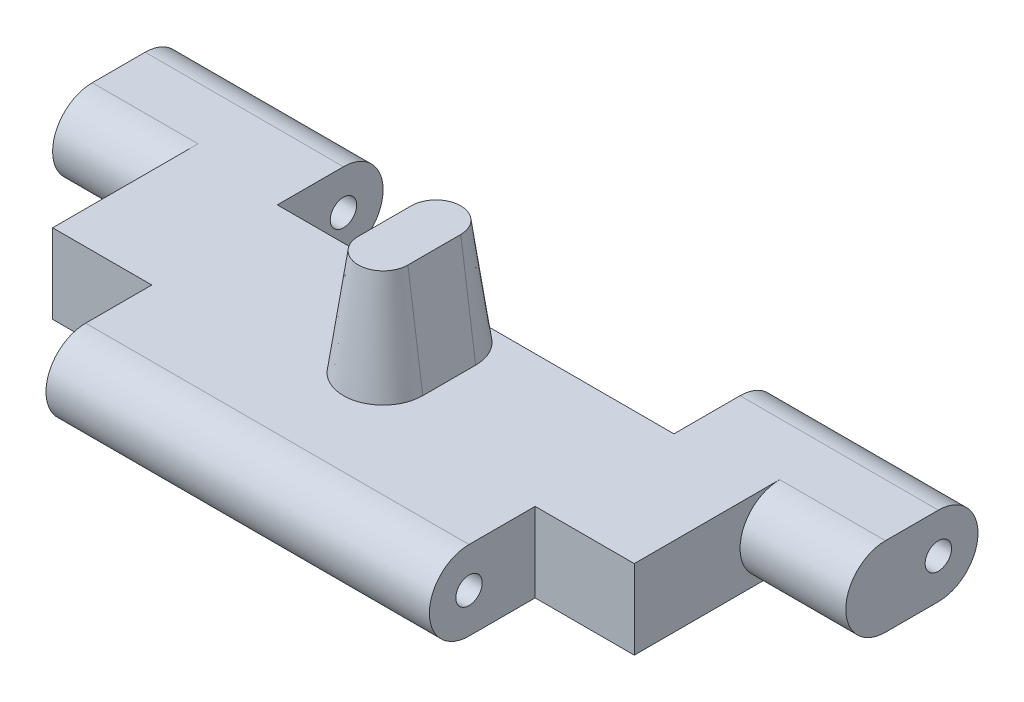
SolidWorks part; units mm, degrees
ref_plane "Plan de face" through (0, 0, 0) normal (0, 0, 1) x (1, 0, 0)
ref_plane "Plan de dessus" through (0, 0, 0) normal (0, 1, 0) x (1, 0, 0)
ref_plane "Plan de droite" through (0, 0, 0) normal (1, 0, 0) x (0, 0, -1)
sketch "Esquisse1" plane through (0, 0, 0) normal (1, 0, 0) x (0, 0, -1)
  line L0 (-5, 0) -> (5, 0) construction
  line L1 (-5, 1.5) -> (5, 1.5)
  line L2 (-5, -1.5) -> (5, -1.5)
  arc A0 (-5, 1.5) -> (-5, -1.5) centre (-5, 0) ccw
  arc A1 (5, -1.5) -> (5, 1.5) centre (5, 0) ccw
  circle A2 centre (-5, 0) radius 0.5
  circle A3 centre (5, 0) radius 0.5
  point P3 (0, 0)
  dimension "D3" = 1
  dimension "D1" = 3
  dimension "D2" = 10
extrude "Boss.-Extru.1" add sketch "Esquisse1" along normal mid plane 30
sketch "Esquisse2" plane through (0, 0, 0) normal (0, 1, 0) x (1, 0, 0)
  line L0 (15, 6.5) -> (-15, 6.5) construction
  line L1 (-7.5, 2.5) -> (7.5, 2.5)
  line L2 (-7.5, 2.5) -> (-7.5, 6.5)
  line L3 (-7.5, 6.5) -> (7.5, 6.5)
  line L4 (7.5, 2.5) -> (7.5, 6.5)
  line L5 (-15, -6.5) -> (-7.25, -6.5)
  line L6 (-15, -6.5) -> (-15, -2.5)
  line L7 (-15, -2.5) -> (-7.25, -2.5)
  line L8 (-7.25, -6.5) -> (-7.25, -2.5)
  line L9 (15, -6.5) -> (7.25, -6.5)
  line L10 (15, -6.5) -> (15, -2.5)
  line L11 (15, -2.5) -> (7.25, -2.5)
  line L12 (7.25, -6.5) -> (7.25, -2.5)
  line L13 (0, -10.0902) -> (0, 2.5) construction
  dimension "D1" = 4
  dimension "D2" = 4
  dimension "D3" = 0.25
  dimension "D4" = 15
extrude "Enlèv. mat.-Extru.1" cut sketch "Esquisse2" against normal through all both and the other way through all
sketch "Esquisse3" plane through (-15, 0, 0) normal (-1, 0, 0) x (0, 0, 1)
  line L0 (-3, 1.5) -> (2.5, 1.5)
  line L1 (-5, 1.5) -> (2.5, 1.5) construction
  line L2 (2.5, 1.5) -> (2.5, -1.5)
  line L3 (2.5, -1.5) -> (-3, -1.5)
  line L4 (2.5, -1.5) -> (-5, -1.5) construction
  line L6 (-1.5, 0) -> (3.5, 0) construction
  arc A0 (-3, -1.5) -> (-3, 1.5) centre (-3, 0) ccw
  arc A1 (-5, 1.5) -> (-5, -1.5) centre (-5, 0) ccw construction
  circle A2 centre (5, 0) radius 1.5 construction
  arc A3 (5, -1.5) -> (5, 1.5) centre (5, 0) ccw construction
  point P20 (-6.5, 0)
  dimension "D1" = 2
  dimension "D2" = 5
  dimension "D3" = 5
extrude "Enlèv. mat.-Extru.2" cut sketch "Esquisse3" against normal blind 4
mirror "Symétrie1" about plane through (0, 0, 0) normal (1, 0, 0) of "Enlèv. mat.-Extru.2"
sketch "Esquisse4" plane through (0, 1.5, 0) normal (0, 1, 0) x (1, 0, 0)
  line L0 (0, 1) -> (0, -1) construction
  line L1 (1.5, 1) -> (1.5, -1)
  line L2 (-1.5, 1) -> (-1.5, -1)
  arc A0 (1.5, 1) -> (-1.5, 1) centre (0, 1) ccw
  arc A1 (-1.5, -1) -> (1.5, -1) centre (0, -1) ccw
  point P2 (0, 0)
  point P7 (0, 0)
  dimension "D1" = 3
  dimension "D2" = 2
extrude "Boss.-Extru.2" add sketch "Esquisse4" along normal blind 4 draft 8
